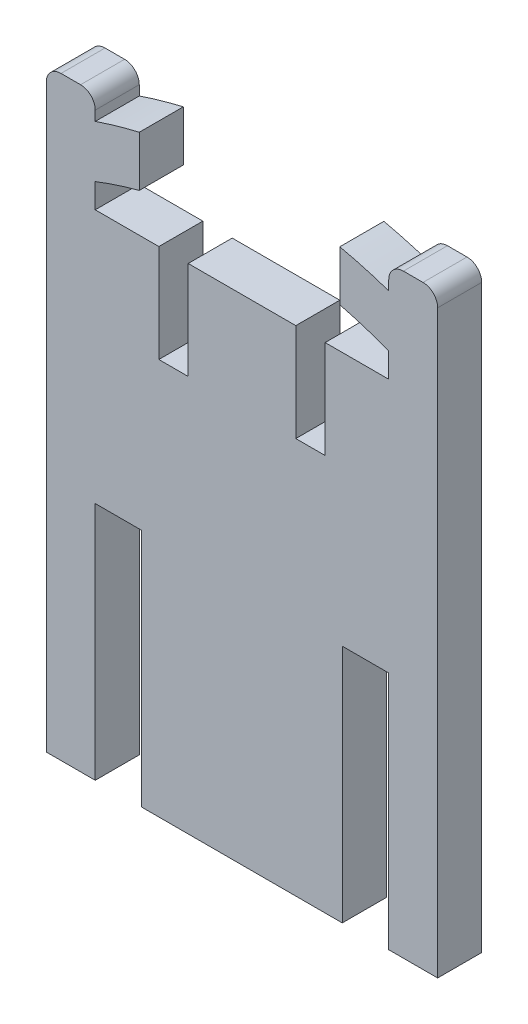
SolidWorks part; units mm, degrees
ref_plane "Plan de face" through (0, 0, 0) normal (0, 0, 1) x (1, 0, 0)
ref_plane "Plan de dessus" through (0, 0, 0) normal (0, 1, 0) x (1, 0, 0)
ref_plane "Plan de droite" through (0, 0, 0) normal (1, 0, 0) x (0, 0, -1)
sketch "Esquisse2" plane through (0, 0, 0) normal (0, 0, 1) x (1, 0, 0)
  line L0 (20.5, 58) -> (20.5, 9)
  line L1 (-30, 9) -> (-30, 58)
  line L2 (30, 58) -> (20.5, 58)
  line L3 (30, 9) -> (30, 58)
  line L4 (-30, 58) -> (-20.5, 58)
  line L5 (-20.5, 58) -> (-20.5, 9)
  line L6 (-30, 9) -> (-40, 9)
  line L7 (30, 9) -> (40, 9)
  line L8 (-40, 9) -> (-40, 127.6479)
  line L9 (-37, 130.6479) -> (-33, 130.6479)
  line L10 (-30, 127.6479) -> (-30, 125.6479)
  line L11 (-30, 110) -> (30, 110)
  line L12 (0, 0) -> (0, 110) construction
  line L13 (30, 127.6479) -> (30, 125.6479)
  line L14 (37, 130.6479) -> (33, 130.6479)
  line L15 (40, 9) -> (40, 127.6479)
  line L16 (-30, 55) -> (-21, 55) construction
  line L17 (-30, 110) -> (-30, 30) construction
  line L22 (-21, 117.9304) -> (-21, 128.2326)
  line L23 (20, 128.4598) -> (20, 118.1869)
  line L24 (-21, 110) -> (-21, 30) construction
  line L25 (-30, 115) -> (-30, 110)
  line L26 (30, 115) -> (30, 110)
  line L27 (20.5, 9) -> (-20.5, 9)
  arc A0 (30, 125.6479) -> (20, 128.4598) centre (0, 38.1479) ccw
  arc A1 (30, 115) -> (20, 118.1869) centre (0, 38.1479) ccw
  arc A2 (26.7568, 116.1884) -> (-26.7568, 116.1884) centre (0, 38.1479) ccw construction
  arc A3 (-21, 117.9304) -> (-30, 115) centre (0, 38.1479) ccw
  arc A4 (-21, 128.2326) -> (-30, 125.6479) centre (0, 38.1479) ccw
  arc A5 (37, 130.6479) -> (40, 127.6479) centre (37, 127.6479) cw
  arc A6 (30, 125.6479) -> (-30, 125.6479) centre (0, 38.1479) ccw construction
  arc A7 (30, 127.6479) -> (33, 130.6479) centre (33, 127.6479) cw
  arc A8 (-33, 130.6479) -> (-30, 127.6479) centre (-33, 127.6479) cw
  arc A9 (-40, 127.6479) -> (-37, 130.6479) centre (-37, 127.6479) cw
  point P32 (40, 130.6479)
  point P36 (30, 130.6479)
  point P39 (-30, 130.6479)
  point P42 (-40, 130.6479)
  dimension "D3" = 10
  dimension "D4" = 5
  dimension "D6" = 3
  dimension "D1" = 9
  dimension "D2" = 9.5
  dimension "D5" = 10
  dimension "D7" = 3
  dimension "D8" = 5
extrude "Boss.-Extru.1" add sketch "Esquisse2" along normal blind 9
sketch "Esquisse3" plane through (0, 0, 0) normal (0, 0, -1) x (-1, 0, 0)
  line L0 (30, 110) -> (-30, 110) construction
  line L1 (-17, 110) -> (-11, 110)
  line L2 (-17, 110) -> (-17, 90)
  line L3 (-17, 90) -> (-11, 90)
  line L4 (-11, 110) -> (-11, 90)
  line L5 (-30, 115) -> (-30, 110) construction
  line L7 (30, 115) -> (30, 110) construction
  line L8 (11, 110) -> (17, 110)
  line L9 (11, 110) -> (11, 90)
  line L10 (11, 90) -> (17, 90)
  line L11 (17, 110) -> (17, 90)
  dimension "D1" = 6
  dimension "D2" = 20
  dimension "D3" = 13
  dimension "D4" = 13
extrude "Enlèv. mat.-Extru.1" cut sketch "Esquisse3" against normal blind 10
